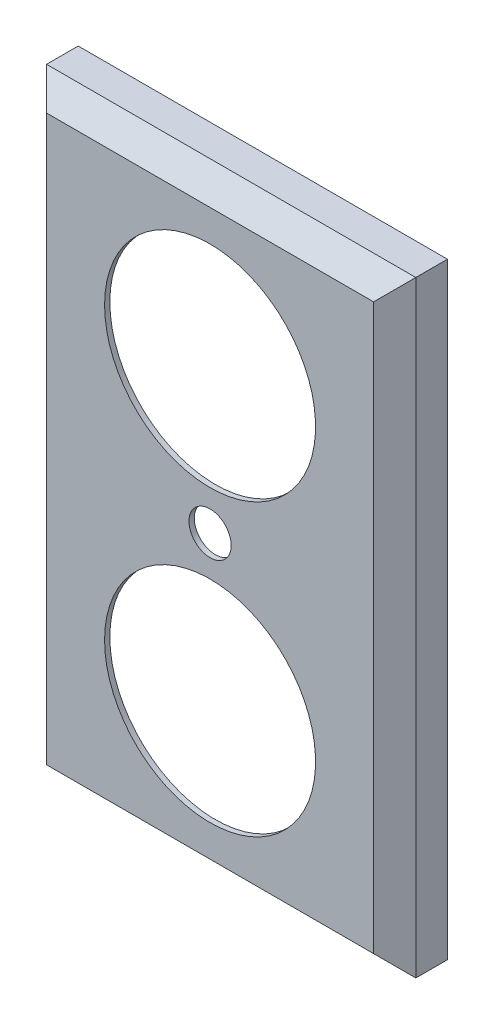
SolidWorks part; units mm, degrees
ref_plane "Front" through (0, 0, 0) normal (0, 0, 1) x (1, 0, 0)
ref_plane "Top" through (0, 0, 0) normal (0, 1, 0) x (1, 0, 0)
ref_plane "Right" through (0, 0, 0) normal (1, 0, 0) x (0, 0, -1)
sketch "Sketch1" plane through (0, 0, 0) normal (0, 0, 1) x (1, 0, 0)
  line L1 (0, 0) -> (70, 0)
  line L2 (0, 0) -> (0, 115)
  line L3 (0, 115) -> (70, 115)
  line L4 (70, 0) -> (70, 115)
  dimension "D1" = 70
  dimension "D2" = 115
extrude "Base-Extrude" add sketch "Sketch1" along normal blind 10
chamfer "Chamfer2" distance 4 angle 45 4 edges at (70, 57.5, 10) (35, 115, 10) (0, 57.5, 10) (35, 0, 10)
shell "Shell1" thickness 1
sketch "Sketch4" plane through (0, 0, 0) normal (0, 0, -1) x (-1, 0, 0)
  line L0 (0, 0) -> (0, 115) construction
  line L1 (-70, 0) -> (0, 0) construction
  circle A0 centre (-35, 85) radius 20
  circle A1 centre (-35, 30) radius 20
  dimension "D1" = 40
  dimension "D2" = 55
  dimension "D3" = 35
  dimension "D4" = 30
extrude "outletcut" cut sketch "Sketch4" against normal through all
sketch "Sketch5" plane through (0, 0, 10) normal (0, 0, 1) x (1, 0, 0)
  line L0 (0, 0) -> (0, 115) construction
  line L1 (70, 0) -> (0, 0) construction
  circle A0 centre (35, 57.5) radius 4
  dimension "D1" = 8
  dimension "D2" = 35
  dimension "D3" = 57.5
extrude "screwhole" cut sketch "Sketch5" against normal through all
